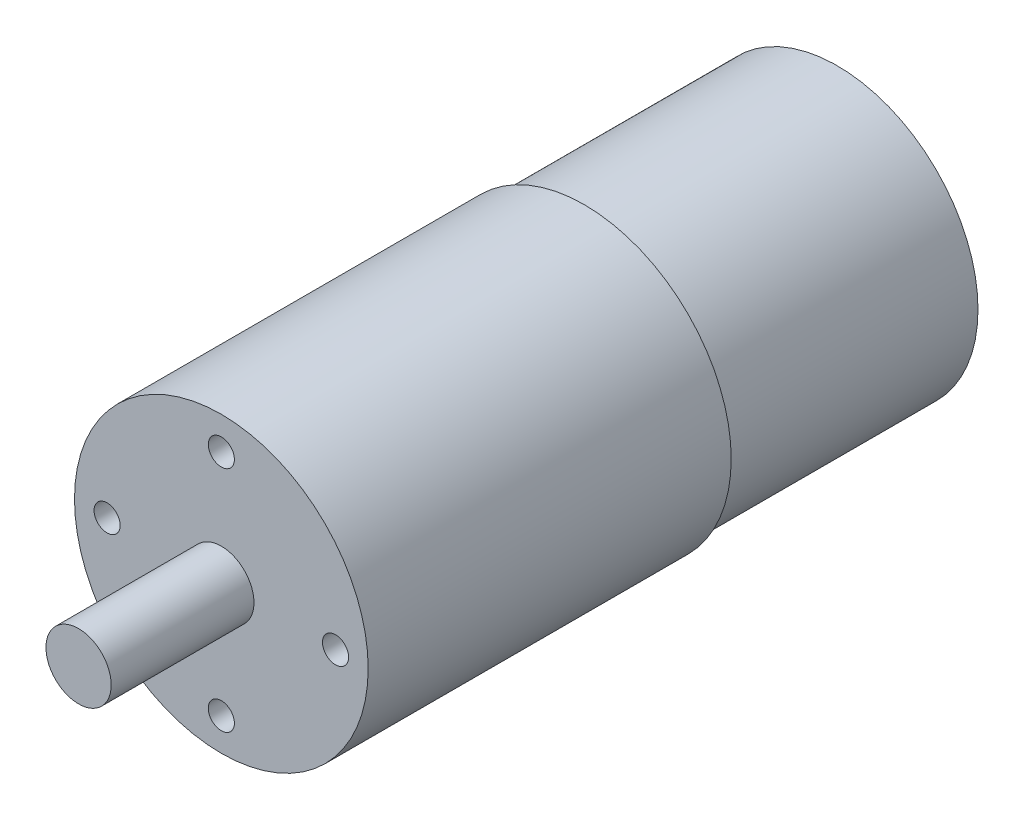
SolidWorks part; units mm, degrees
ref_plane "前视基准面" through (0, 0, 0) normal (0, 0, 1) x (1, 0, 0)
ref_plane "上视基准面" through (0, 0, 0) normal (0, 1, 0) x (1, 0, 0)
ref_plane "右视基准面" through (0, 0, 0) normal (1, 0, 0) x (0, 0, -1)
sketch "草图1" plane through (0, 0, 0) normal (0, 0, 1) x (1, 0, 0)
  circle A0 centre (0, 0) radius 17.25
  dimension "D1" = 34.5
extrude "凸台-拉伸1" add sketch "草图1" along normal blind 31
sketch "草图2" plane through (0, 0, 31) normal (0, 0, 1) x (1, 0, 0)
  circle A0 centre (0, 0) radius 18
  dimension "D1" = 36
extrude "凸台-拉伸2" add sketch "草图2" along normal blind 44.5
sketch "草图3" plane through (0, 0, 75.5) normal (0, 0, 1) x (1, 0, 0)
  circle A0 centre (0, 0) radius 4
  dimension "D1" = 8
extrude "凸台-拉伸3" add sketch "草图3" along normal blind 17.5
sketch "草图4" plane through (0, 0, 75.5) normal (0, 0, 1) x (1, 0, 0)
  line L0 (0, 0) -> (0, 14) construction
  circle A0 centre (0, 14) radius 1.6
  circle A1 centre (14, 0) radius 1.6
  circle A2 centre (0, -14) radius 1.6
  circle A3 centre (-14, 0) radius 1.6
  point P13 (0, 0)
  dimension "D2" = 3.2
  dimension "D1" = 14
  dimension "D3" = 4
extrude "切除-拉伸1" cut sketch "草图4" against normal blind 5
sketch "草图6" plane through (0, 0, 0) normal (0, 1, 0) x (1, 0, 0)
  line L0 (-11, 2) -> (-11, 0)
  line L1 (17.25, 0) -> (-17.25, 0) construction
  line L2 (-11, 0) -> (-9, 0)
  line L3 (-9, 0) -> (-9, 2)
  line L4 (0, 0) -> (0, -2.5303) construction
  line L5 (9, 0) -> (9, 2)
  line L6 (11, 0) -> (9, 0)
  line L7 (11, 2) -> (11, 0)
  arc A0 (-9, 2) -> (-11, 2) centre (-10, 2) ccw
  circle A1 centre (-10, 2) radius 0.75
  circle A2 centre (10, 2) radius 0.75
  arc A3 (9, 2) -> (11, 2) centre (10, 2) cw
  dimension "D1" = 2
  dimension "D4" = 1.5
  dimension "D2" = 10
  dimension "D3" = 2
extrude "凸台-拉伸4" add sketch "草图6" along normal mid plane 1
sketch "草图7" plane through (0, 0, 93) normal (0, 0, 1) x (1, 0, 0)
  circle A0 centre (0, 0) radius 4 construction
  circle A1 centre (0, 0) radius 4
